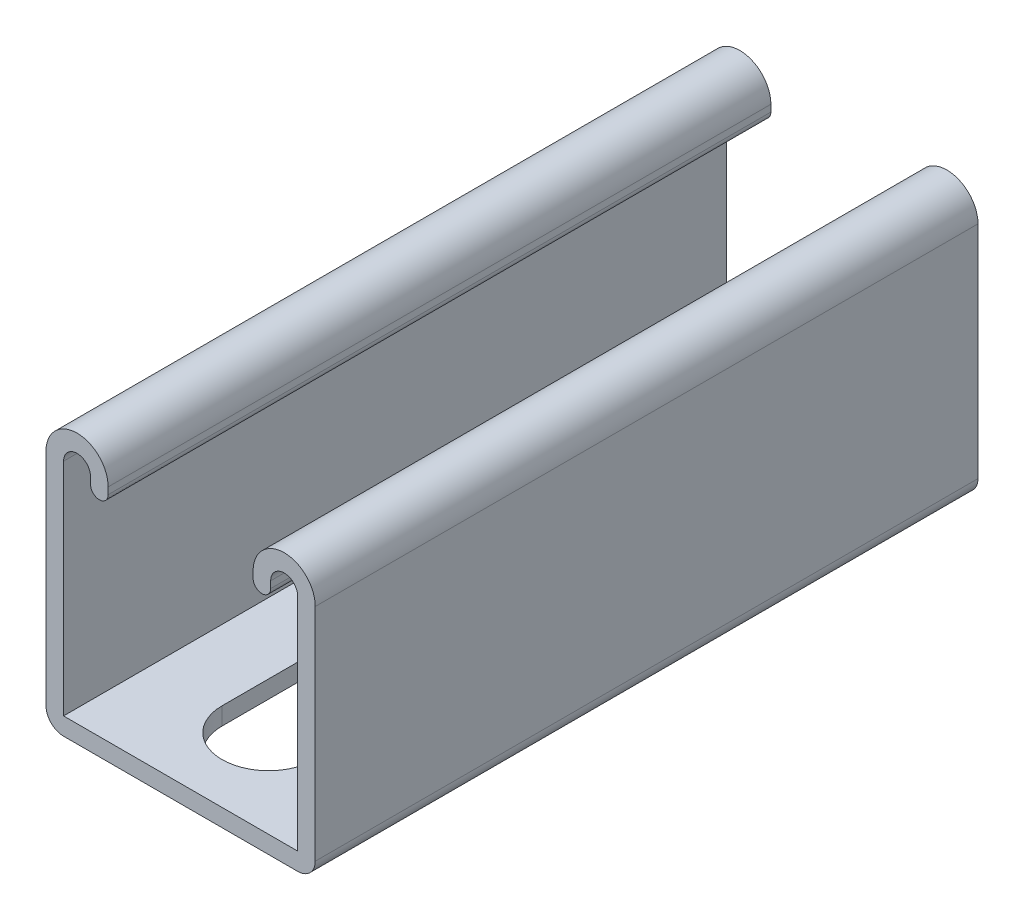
SolidWorks part; units mm, degrees
ref_plane "Plane1" through (0, 0, 0) normal (0, 0, 1) x (1, 0, 0)
ref_plane "Plane2" through (0, 0, 0) normal (0, 1, 0) x (1, 0, 0)
ref_plane "Plane3" through (0, 0, 0) normal (1, 0, 0) x (0, 0, -1)
sketch "Sketch1" plane through (0, 0, 0) normal (0, 0, 1) x (1, 0, 0)
  line L0 (-20.6375, 18.4785) -> (-20.6375, -15.3416)
  line L1 (-17.9451, -18.034) -> (17.9451, -18.034)
  line L2 (20.6375, -15.3416) -> (20.6375, 18.4785)
  line L3 (11.1125, 18.4785) -> (11.1125, 17.4434)
  line L4 (-11.1125, 18.4785) -> (-11.1125, 17.4434)
  line L5 (-13.8049, 18.4785) -> (-13.8049, 17.4434)
  line L6 (-17.9451, 18.4785) -> (-17.9451, -15.3416)
  line L7 (-17.9451, -15.3416) -> (17.9451, -15.3416)
  line L8 (17.9451, -15.3416) -> (17.9451, 18.4785)
  line L9 (13.8049, 18.4785) -> (13.8049, 17.4434)
  line L10 (-25.4, 23.241) -> (25.4, 23.241) construction
  line L11 (-12.8524, 16.0972) -> (12.8524, 16.0972) construction
  arc A0 (20.6375, 18.4785) -> (11.1125, 18.4785) centre (15.875, 18.4785) ccw
  arc A1 (-20.6375, 18.4785) -> (-11.1125, 18.4785) centre (-15.875, 18.4785) cw
  arc A2 (-17.9451, -18.034) -> (-20.6375, -15.3416) centre (-17.9451, -15.3416) cw
  arc A3 (17.9451, -18.034) -> (20.6375, -15.3416) centre (17.9451, -15.3416) ccw
  arc A4 (-17.9451, 18.4785) -> (-13.8049, 18.4785) centre (-15.875, 18.4785) cw
  arc A5 (17.9451, 18.4785) -> (13.8049, 18.4785) centre (15.875, 18.4785) ccw
  arc A6 (11.1125, 17.4434) -> (13.8049, 17.4434) centre (12.4587, 17.4434) ccw
  arc A7 (-11.1125, 17.4434) -> (-13.8049, 17.4434) centre (-12.4587, 17.4434) cw
  dimension "D1" = 2.6924
  dimension "D3" = 20.6375
  dimension "Width" = 41.275
  dimension "D5" = 18.034
  dimension "D6" = 9.525
  dimension "D7" = 22.225
  dimension "D8" = 23.241
  dimension "D9" = 7.1437
  dimension "gauge" = 2.6924
extrude "Base-Extrude" add sketch "Sketch1" along normal blind 101.6
extrude "Slot" cut sketch "Sketch2" against normal through all
sketch "Sketch2" plane through (-0.0935, -18.034, -6.336) normal (0, -1, 0) x (1, 0, 0)
  line L0 (7.2372, 43.6422) -> (7.2372, 29.3547)
  line L1 (-7.0503, 29.3547) -> (-7.0503, 43.6422)
  arc A0 (-7.0503, 29.3547) -> (7.2372, 29.3547) centre (0.0935, 29.3547) ccw
  arc A1 (7.2372, 43.6422) -> (-7.0503, 43.6422) centre (0.0935, 43.6422) ccw
  dimension "D3" = 14.2875
  dimension "D1" = 23.0188
  dimension "D2" = 14.2875
pattern_linear "LPattern1" count 2 spacing 50.8 along (0, 0, 1) of "Slot"
equation "\"D3@Sketch1\" = \"Width@Sketch1\" / 2"
equation "\"D7@Sketch1\" = \"Width@Sketch1\" - 2 * \"D6@Sketch1\""
equation "\"D1@Sketch1\" = \"gauge@Sketch1\""
equation "\"D1@LPattern1\" = \"D1@Base-Extrude\" / \"D3@LPattern1\""
